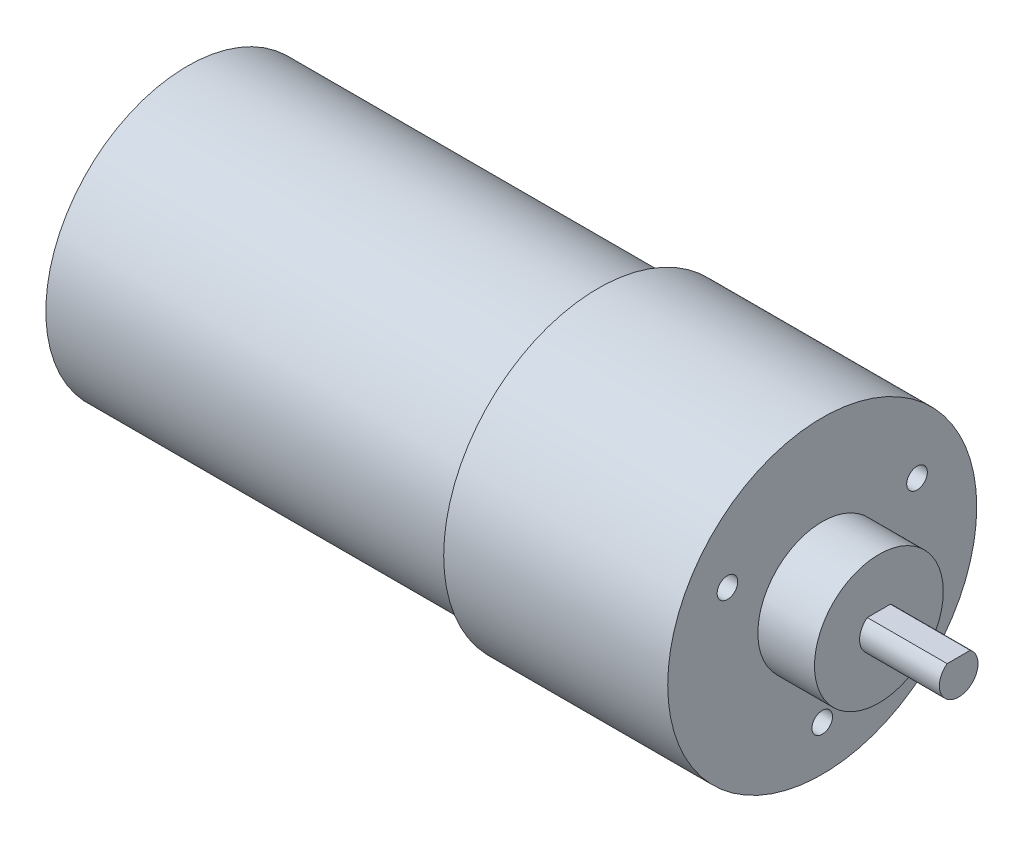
SolidWorks part; units mm, degrees
ref_plane "Front" through (0, 0, 0) normal (0, 0, 1) x (1, 0, 0)
ref_plane "Top" through (0, 0, 0) normal (0, 1, 0) x (1, 0, 0)
ref_plane "Right" through (0, 0, 0) normal (1, 0, 0) x (0, 0, -1)
sketch "Sketch1" plane through (0, 0, 0) normal (1, 0, 0) x (0, 0, -1)
  circle A0 centre (0, 0) radius 11
  dimension "D1" = 22
extrude "Extrude1" add sketch "Sketch1" along normal blind 31.9
sketch "Sketch2" plane through (31.9, 0, 0) normal (1, 0, 0) x (0, 0, -1)
  circle A0 centre (0, 0) radius 12
  dimension "D1" = 24
extrude "Extrude2" add sketch "Sketch2" along normal blind 17.4
sketch "Sketch3" plane through (49.3, 0, 0) normal (1, 0, 0) x (0, 0, -1)
  circle A0 centre (0, 0) radius 5
  dimension "D1" = 10
extrude "Extrude3" add sketch "Sketch3" along normal blind 4.4
sketch "Sketch4" plane through (53.7, 0, 0) normal (1, 0, 0) x (0, 0, -1)
  line L0 (-0.9, 1.2) -> (0.9, 1.2)
  line L1 (0, 1.2) -> (0, -1.5) construction
  arc A0 (-0.9, 1.2) -> (0.9, 1.2) centre (0, 0) ccw
  dimension "D1" = 3
  dimension "D2" = 2.7
extrude "Extrude4" add sketch "Sketch4" along normal blind 6.2
sketch "Sketch5" plane through (49.3, 0, 0) normal (1, 0, 0) x (0, 0, -1)
  circle A0 centre (0, 0) radius 8.5 construction
  circle A1 centre (0, -8.5) radius 0.8
  circle A2 centre (-7.3612, 4.25) radius 0.8
  circle A3 centre (7.3612, 4.25) radius 0.8
  dimension "D1" = 17
  dimension "D2" = 1.6
extrude "Extrude5" cut sketch "Sketch5" against normal blind 1.5
